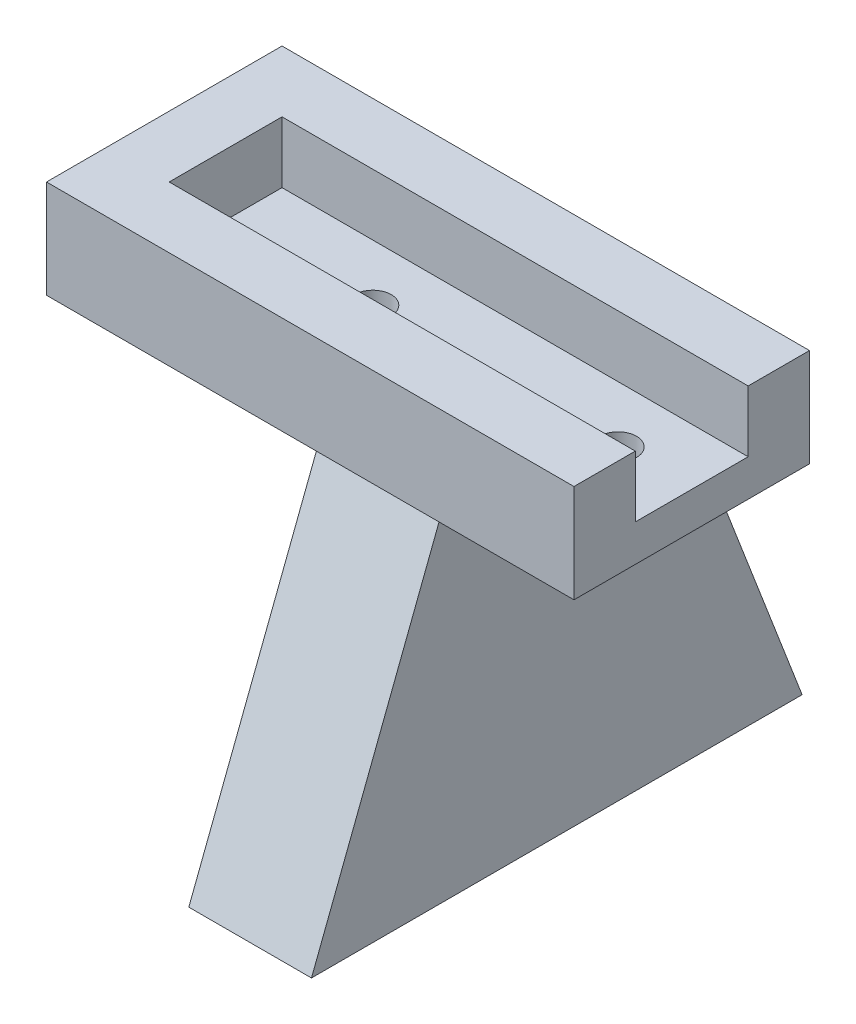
SolidWorks part; units mm, degrees
ref_plane "Front Plane" through (0, 0, 0) normal (0, 0, 1) x (1, 0, 0)
ref_plane "Top Plane" through (0, 0, 0) normal (0, 1, 0) x (1, 0, 0)
ref_plane "Right Plane" through (0, 0, 0) normal (1, 0, 0) x (0, 0, -1)
sketch "Sketch1" plane through (0, 0, 0) normal (0, 1, 0) x (1, 0, 0)
  line L1 (26, 4.5) -> (26, -4.5)
  line L3 (-11.5, 4.5) -> (26, 4.5)
  line L5 (26, -4.5) -> (-11.5, -4.5)
  line L6 (-11.5, -4.5) -> (-11.5, 4.5)
  line L7 (10, 4.5) -> (10, -4.5)
  circle A0 centre (0, 0) radius 1.5
  circle A1 centre (20, 0) radius 1.5
sketch "Sketch3" plane through (0, 0, 0) normal (1, 0, 0) x (0, 0, -1)
  line L0 (-4.6, 0) -> (-4.6, 5)
  line L3 (-4.6, 0) -> (4.6, 0)
  line L4 (-4.6, 5) -> (-9.6, 5)
  line L5 (4.6, 0) -> (4.6, 5)
  line L6 (4.6, 5) -> (9.6, 5)
  line L7 (-9.6, -3) -> (9.6, -3)
  line L8 (-9.6, 5) -> (-9.6, -3)
  line L10 (9.6, -3) -> (9.6, 5)
extrude "Boss-Extrude1" add sketch "Sketch3" along normal blind 26 and the other way blind 12
sketch "Sketch4" plane through (0, 0, 0) normal (0, 1, 0) x (1, 0, 0)
  circle A0 centre (0, 0) radius 1.5
  circle A1 centre (20, 0) radius 1.5
extrude "Cut-Extrude1" cut sketch "Sketch4" against normal through all both and the other way through all
ref_plane "Plane1" through (10, 0, 0) normal (1, 0, 0) x (0, 0, -1)
sketch "Sketch6" plane through (10, 0, 0) normal (1, 0, 0) x (0, 0, -1)
  line L0 (-20, -30) -> (-9.6, -3)
  line L1 (-9.6, -3) -> (9.6, -3)
  line L2 (-20, -30) -> (20, -30)
  line L3 (20, -30) -> (9.6, -3)
extrude "Boss-Extrude2" add sketch "Sketch6" along normal mid plane 10
sketch "Sketch7" plane through (-12, 0, 0) normal (-1, 0, 0) x (0, 0, 1)
  line L0 (-9.6, 5) -> (9.6, 5)
  line L1 (9.6, 5) -> (9.6, -3)
  line L2 (9.6, -3) -> (-9.6, -3)
  line L3 (-9.6, -3) -> (-9.6, 5)
extrude "Boss-Extrude3" add sketch "Sketch7" along normal blind 5
